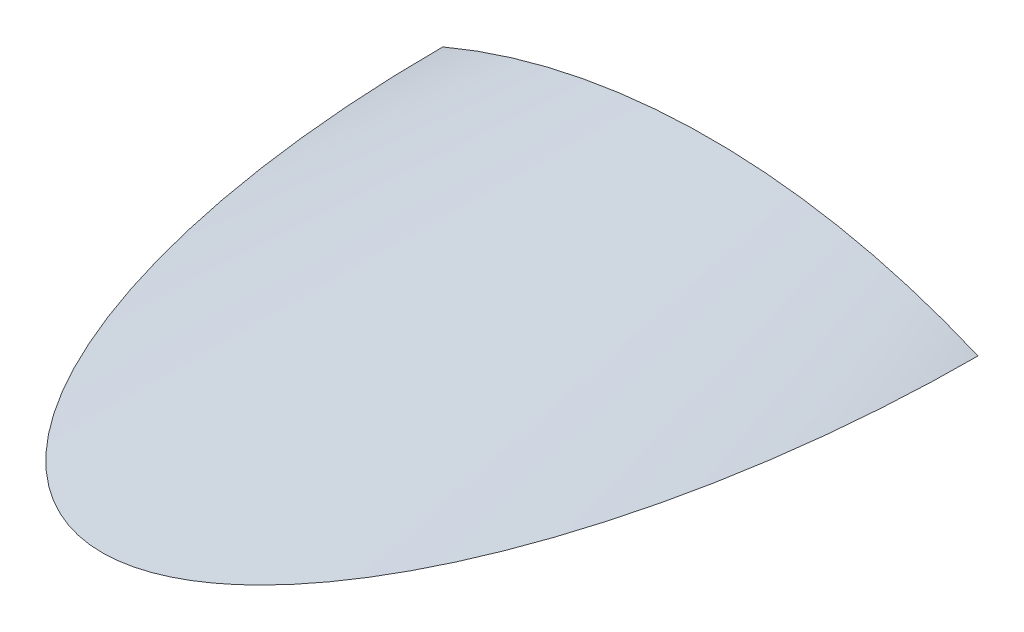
SolidWorks part; units mm, degrees
ref_plane "Ebene vorne" through (0, 0, 0) normal (0, 0, 1) x (1, 0, 0)
ref_plane "Ebene oben" through (0, 0, 0) normal (0, 1, 0) x (1, 0, 0)
ref_plane "Ebene rechts" through (0, 0, 0) normal (1, 0, 0) x (0, 0, -1)
sketch "Skizze1" plane through (0, 0, 0) normal (0, 0, 1) x (1, 0, 0)
  line L0 (0, 49.2022) -> (0, 0) construction
  line L1 (-47.4056, 0) -> (47.4056, 0) construction
  arc A0 (47.4056, 0) -> (-47.4056, 0) centre (0, -111.5141) ccw
sketch "Skizze2" plane through (0, 0, 0) normal (0, 1, 0) x (1, 0, 0)
  line L0 (-47.4056, 0) -> (47.4056, 0) construction
  ellipse E0 centre (0, 0) end of major axis (0, 107.7496) minor radius 47.4056 (-47.4056, 0) -> (47.4056, 0) ccw
surface "Oberfläche-Ausformung1"
equation "\"LÄNGE\"=0"
equation "\"BREITE\"=0"
equation "\"HÖHE\"=0"
equation "\"DURCHMESSER\"=0"
equation "\"Stückzahl\"= 1"
